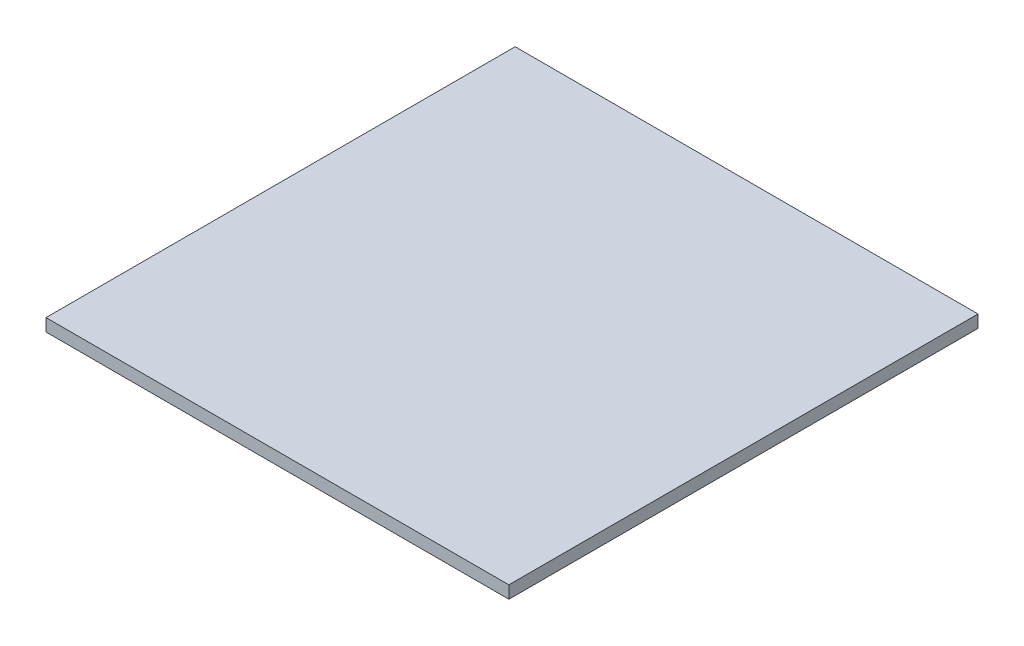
SolidWorks part; units mm, degrees
ref_plane "Plan de face" through (0, 0, 0) normal (0, 0, 1) x (1, 0, 0)
ref_plane "Plan de dessus" through (0, 0, 0) normal (0, 1, 0) x (1, 0, 0)
ref_plane "Plan de droite" through (0, 0, 0) normal (1, 0, 0) x (0, 0, -1)
sketch "Esquisse1" plane through (0, 0, 0) normal (0, 1, 0) x (1, 0, 0)
  line L1 (0, 0) -> (74, 0)
  line L2 (0, 0) -> (0, 75)
  line L3 (0, 75) -> (74, 75)
  line L4 (74, 0) -> (74, 75)
extrude "Extrusion1" add sketch "Esquisse1" along normal blind 2
